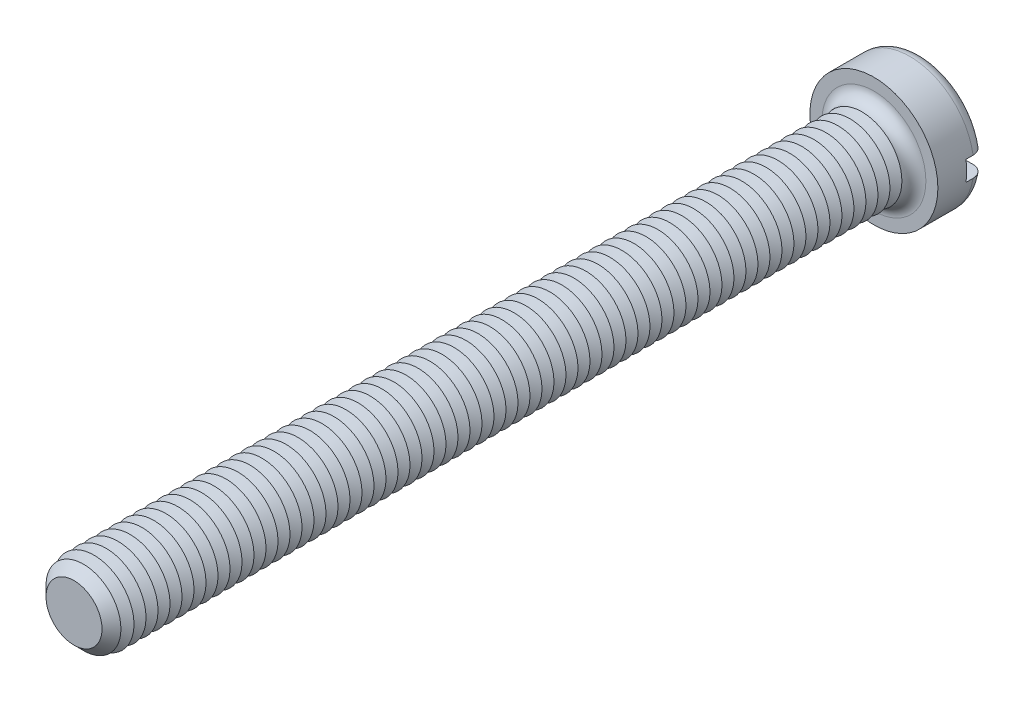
SolidWorks part; units mm, degrees
ref_plane "Front Plane" through (0, 0, 0) normal (0, 0, 1) x (1, 0, 0)
ref_plane "Top Plane" through (0, 0, 0) normal (0, 1, 0) x (1, 0, 0)
ref_plane "Right Plane" through (0, 0, 0) normal (1, 0, 0) x (0, 0, -1)
sketch "Sketch3" plane through (0, 0, 0) normal (0, 0, 1) x (1, 0, 0)
  circle A0 centre (0, 0) radius 8
  dimension "D1" = 16
extrude "Boss-Extrude2" add sketch "Sketch3" against normal blind 6
sketch "Sketch4" plane through (0, 0, 0) normal (0, 0, 1) x (1, 0, 0)
  circle A0 centre (0, 0) radius 5
  dimension "D1" = 10
extrude "Boss-Extrude3" add sketch "Sketch4" along normal blind 100
fillet "Fillet1" radius 1.5 2 edges at (8, 0, -6) (5, 0, 0)
chamfer "Chamfer1" distance 1.5 angle 45 1 edges at (5, 0, 100)
sketch "Sketch5" plane through (0, 0, 0) normal (1, 0, 0) x (0, 0, -1)
  line L0 (1.6944, 0) -> (-7.6738, 0) construction
sketch "Sketch6" plane through (0, 0, 0) normal (1, 0, 0) x (0, 0, -1)
  line L0 (-1.5, 5) -> (-2.25, 3.701)
  line L1 (-2.25, 3.701) -> (-3, 5)
  line L2 (-1.5, 5) -> (-98.5, 5) construction
  line L3 (-3, 5) -> (-1.5, 5)
  dimension "D1" = 1.5
revolve "Cut-Revolve1" cut sketch "Sketch6" angle 360 about L0
pattern_linear "LPattern1" count 65 spacing 1.5 along (0, 0, 1) of "Cut-Revolve1"
sketch "Sketch8" plane through (0, 0, -6) normal (0, 0, -1) x (-1, 0, 0)
  line L1 (8, -1.25) -> (-8, -1.25)
  line L2 (8, -1.25) -> (8, 1.25)
  line L3 (8, 1.25) -> (-8, 1.25)
  line L4 (-8, -1.25) -> (-8, 1.25)
  line L5 (8, -1.25) -> (-8, 1.25) construction
  line L6 (8, 1.25) -> (-8, -1.25) construction
  point P0 (0, 0)
  dimension "D1" = 16
  dimension "D2" = 2.5
extrude "Cut-Extrude1" cut sketch "Sketch8" against normal blind 2.4
